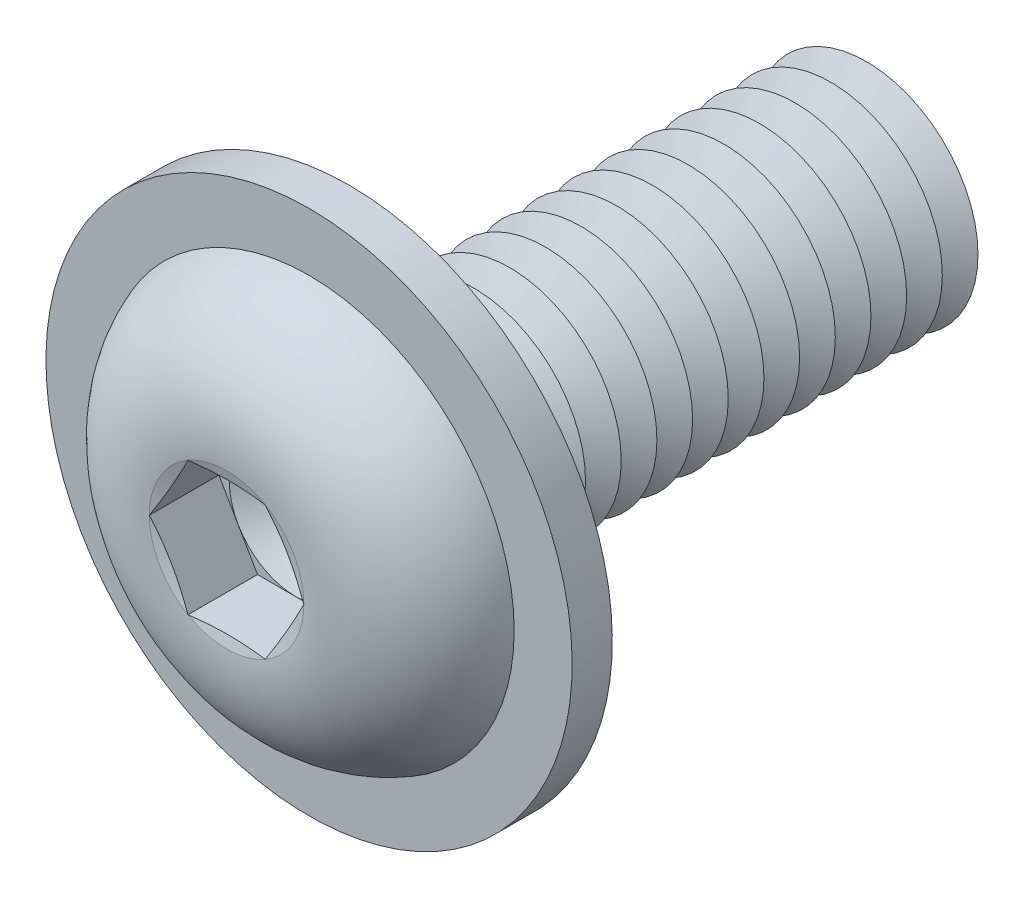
SolidWorks part; units mm, degrees
ref_plane "Front Plane" through (0, 0, 0) normal (0, 0, 1) x (1, 0, 0)
ref_plane "Top Plane" through (0, 0, 0) normal (0, 1, 0) x (1, 0, 0)
ref_plane "Right Plane" through (0, 0, 0) normal (1, 0, 0) x (0, 0, -1)
sketch "Sketch1" plane through (0, 0, 0) normal (1, 0, 0) x (0, 0, -1)
  line L0 (0, 2.5) -> (0, 4.75)
  line L3 (0, 2.5) -> (12, 2.5)
  line L4 (12, 2.5) -> (12, 0)
  line L5 (12, 0) -> (-2.75, 0) construction
  line L6 (-2.75, 0) -> (12, 0)
  line L7 (-2.75, 1.732) -> (-2.75, 0.866) construction
  line L8 (-2.75, 0.866) -> (-2.75, 0)
  line L9 (-2.75, 1.732) -> (-2.5179, 0.866)
  line L10 (-2.5179, 0.866) -> (-2.75, 0.866)
  line L11 (12, 0) -> (22.7481, 0) construction
  line L12 (0, 4.75) -> (-2.75, 4.75) construction
  arc A1 (0, 4.75) -> (-2.75, 1.732) centre (0, 1.9881) ccw
  point P8 (12, 1.25)
  dimension "D1" = 9.5
  dimension "D2" = 5
  dimension "D3" = 2.75
  dimension "D4" = 3.4641
  dimension "D5" = 12
  dimension "D6" = 15
revolve "Revolve1" add sketch "Sketch1" angle 360 about L5
fillet "Fillet1" radius 0.4 1 edges at (-2.5, 0, 0)
sketch "Sketch2" plane through (0, 0, 0) normal (1, 0, 0) x (0, 0, -1)
  line L0 (11.6, 2.5) -> (12.4, 2.5)
  line L1 (12, 2.5) -> (0.4, 2.5) construction
  line L2 (12.4, 2.5) -> (12, 1.8072)
  line L3 (12, -2.5) -> (12, 2.5) construction
  line L4 (12, 1.8072) -> (11.6, 2.5)
  dimension "D1" = 0.8
revolve "Cut-Revolve1" cut sketch "Sketch2" angle 360 about axis through (0, 0, -12) along (0, 0, -1)
pattern_linear "LPattern1" count 15 spacing 0.8 along (0, 0, 1) of "Cut-Revolve1"
sketch "Sketch3" plane through (0, 0, 2.75) normal (0, 0, 1) x (1, 0, 0)
  line L7 (0.866, 1.5) -> (-0.866, 1.5)
  line L8 (-0.866, 1.5) -> (-1.7321, 0)
  line L9 (-1.7321, 0) -> (-0.866, -1.5)
  line L10 (-0.866, -1.5) -> (0.866, -1.5)
  line L11 (0.866, -1.5) -> (1.732, 0)
  line L12 (1.732, 0) -> (0.866, 1.5)
  circle A0 centre (0, 0) radius 1.5 construction
  circle A3 centre (0, 0) radius 1.7321 construction
extrude "Cut-Extrude1" cut sketch "Sketch3" against normal blind 1.56
sketch "Sketch4" plane through (0, 0, 1.19) normal (0, 0, 1) x (1, 0, 0)
  line L1 (0.866, 1.5) -> (-0.866, 1.5) construction
  circle A0 centre (0, 0) radius 1.5
extrude "Cut-Extrude2" cut sketch "Sketch4" against normal through all draft 60
sketch "Sketch5" plane through (0, 0, 0) normal (0, 0, -1) x (-1, 0, 0)
  circle A0 centre (0, 0) radius 5.9
  circle A1 centre (0, 0) radius 2.9
  circle A2 centre (0, 0) radius 2.9 construction
  dimension "D1" = 11.8
extrude "Boss-Extrude1" add sketch "Sketch5" against normal blind 0.9
